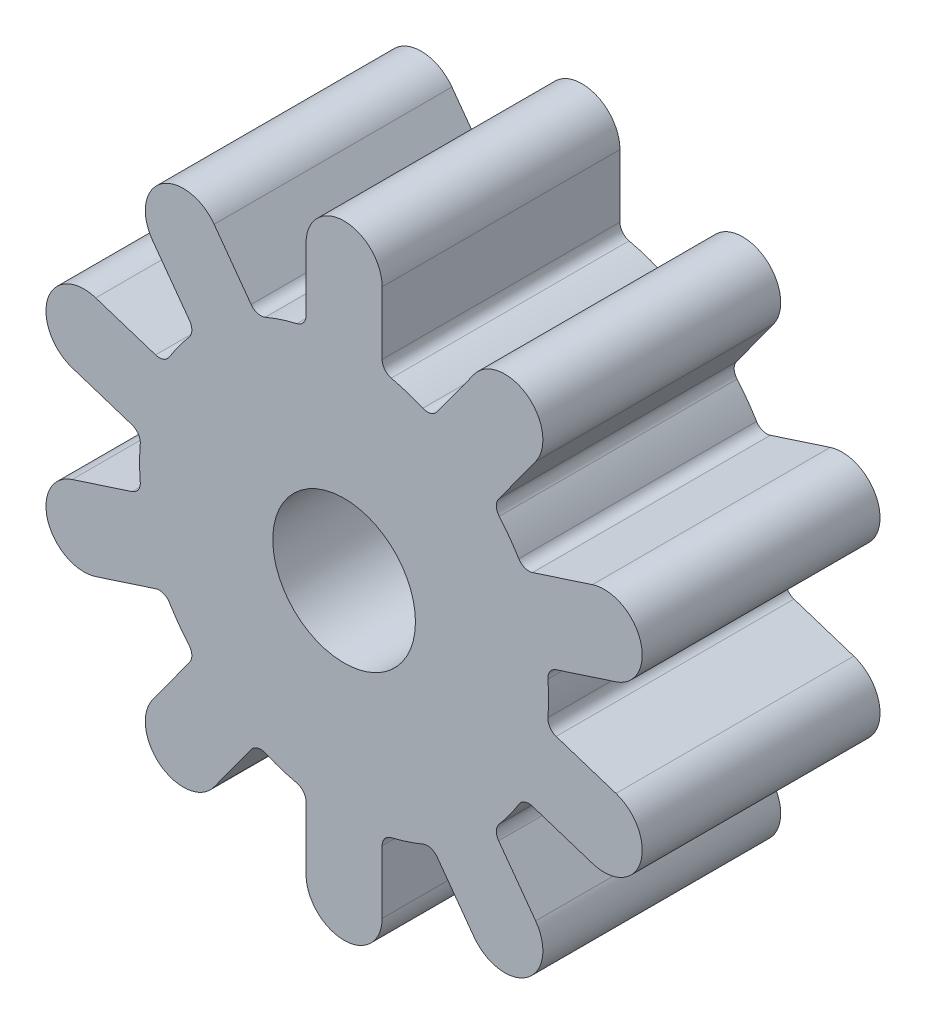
SolidWorks part; units mm, degrees
ref_plane "Front Plane" through (0, 0, 0) normal (0, 0, 1) x (1, 0, 0)
ref_plane "Top Plane" through (0, 0, 0) normal (0, 1, 0) x (1, 0, 0)
ref_plane "Right Plane" through (0, 0, 0) normal (1, 0, 0) x (0, 0, -1)
sketch "Sketch1" plane through (0, 0, 0) normal (0, 0, 1) x (1, 0, 0)
  line L0 (-1.6, 11.5) -> (-1.6, 8.8544)
  line L1 (1.6, 11.5) -> (1.6, 8.8544)
  line L2 (5.4651, 10.2442) -> (3.91, 8.1038)
  line L3 (8.054, 8.3632) -> (6.4989, 6.2229)
  line L4 (10.4427, 5.0754) -> (7.9266, 4.2578)
  line L5 (11.4316, 2.032) -> (8.9154, 1.2145)
  line L6 (11.4316, -2.032) -> (8.9154, -1.2145)
  line L7 (10.4427, -5.0754) -> (7.9266, -4.2578)
  line L8 (8.054, -8.3632) -> (6.4989, -6.2229)
  line L9 (5.4651, -10.2442) -> (3.91, -8.1038)
  line L10 (1.6, -11.5) -> (1.6, -8.8544)
  line L11 (-1.6, -11.5) -> (-1.6, -8.8544)
  line L12 (-5.4651, -10.2442) -> (-3.91, -8.1038)
  line L13 (-8.054, -8.3632) -> (-6.4989, -6.2229)
  line L14 (-10.4427, -5.0754) -> (-7.9266, -4.2578)
  line L15 (-11.4316, -2.032) -> (-8.9154, -1.2145)
  line L16 (-11.4316, 2.032) -> (-8.9154, 1.2145)
  line L17 (-10.4427, 5.0754) -> (-7.9266, 4.2578)
  line L18 (-8.054, 8.3632) -> (-6.4989, 6.2229)
  line L19 (-5.4651, 10.2442) -> (-3.91, 8.1038)
  arc A0 (1.6, 8.8544) -> (1.9846, 8.3679) centre (2.1, 8.8544) ccw
  arc A1 (-1.9846, 8.3679) -> (-3.3129, 7.9363) centre (0, 0) ccw
  arc A2 (1.6, 11.5) -> (-1.6, 11.5) centre (0, 11.5) ccw
  arc A3 (-1.6, 8.8544) -> (-1.9846, 8.3679) centre (-2.1, 8.8544) cw
  arc A4 (3.91, 8.1038) -> (3.3129, 7.9363) centre (3.5055, 8.3977) cw
  arc A5 (8.054, 8.3632) -> (5.4651, 10.2442) centre (6.7595, 9.3037) ccw
  arc A6 (6.4989, 6.2229) -> (6.5241, 5.6032) centre (6.9034, 5.929) ccw
  arc A7 (7.9266, 4.2578) -> (7.345, 4.4733) centre (7.7721, 4.7334) cw
  arc A8 (11.4316, 2.032) -> (10.4427, 5.0754) centre (10.9371, 3.5537) ccw
  arc A9 (8.9154, 1.2145) -> (8.5716, 0.6983) centre (9.0699, 0.7389) ccw
  arc A10 (8.9154, -1.2145) -> (8.5716, -0.6983) centre (9.0699, -0.7389) cw
  arc A11 (10.4427, -5.0754) -> (11.4316, -2.032) centre (10.9371, -3.5537) ccw
  arc A12 (7.9266, -4.2578) -> (7.345, -4.4733) centre (7.7721, -4.7334) ccw
  arc A13 (6.4989, -6.2229) -> (6.5241, -5.6032) centre (6.9034, -5.929) cw
  arc A14 (5.4651, -10.2442) -> (8.054, -8.3632) centre (6.7595, -9.3037) ccw
  arc A15 (3.91, -8.1038) -> (3.3129, -7.9363) centre (3.5055, -8.3977) ccw
  arc A16 (1.6, -8.8544) -> (1.9846, -8.3679) centre (2.1, -8.8544) cw
  arc A17 (-1.6, -11.5) -> (1.6, -11.5) centre (0, -11.5) ccw
  arc A18 (-1.6, -8.8544) -> (-1.9846, -8.3679) centre (-2.1, -8.8544) ccw
  arc A19 (-3.91, -8.1038) -> (-3.3129, -7.9363) centre (-3.5055, -8.3977) cw
  arc A20 (-8.054, -8.3632) -> (-5.4651, -10.2442) centre (-6.7595, -9.3037) ccw
  arc A21 (-6.4989, -6.2229) -> (-6.5241, -5.6032) centre (-6.9034, -5.929) ccw
  arc A22 (-7.9266, -4.2578) -> (-7.345, -4.4733) centre (-7.7721, -4.7334) cw
  arc A23 (-11.4316, -2.032) -> (-10.4427, -5.0754) centre (-10.9371, -3.5537) ccw
  arc A24 (-8.9154, -1.2145) -> (-8.5716, -0.6983) centre (-9.0699, -0.7389) ccw
  arc A25 (-8.9154, 1.2145) -> (-8.5716, 0.6983) centre (-9.0699, 0.7389) cw
  arc A26 (-10.4427, 5.0754) -> (-11.4316, 2.032) centre (-10.9371, 3.5537) ccw
  arc A27 (-7.9266, 4.2578) -> (-7.345, 4.4733) centre (-7.7721, 4.7334) ccw
  arc A28 (-6.4989, 6.2229) -> (-6.5241, 5.6032) centre (-6.9034, 5.929) cw
  arc A29 (-5.4651, 10.2442) -> (-8.054, 8.3632) centre (-6.7595, 9.3037) ccw
  arc A30 (-3.91, 8.1038) -> (-3.3129, 7.9363) centre (-3.5055, 8.3977) ccw
  arc A31 (-6.5241, 5.6032) -> (-7.345, 4.4733) centre (0, 0) ccw
  arc A32 (3.3129, 7.9363) -> (1.9846, 8.3679) centre (0, 0) ccw
  arc A33 (-8.5716, 0.6983) -> (-8.5716, -0.6983) centre (0, 0) ccw
  arc A34 (-7.345, -4.4733) -> (-6.5241, -5.6032) centre (0, 0) ccw
  arc A35 (7.345, 4.4733) -> (6.5241, 5.6032) centre (0, 0) ccw
  arc A36 (8.5716, -0.6983) -> (8.5716, 0.6983) centre (0, 0) ccw
  arc A37 (6.5241, -5.6032) -> (7.345, -4.4733) centre (0, 0) ccw
  arc A38 (-3.3129, -7.9363) -> (-1.9846, -8.3679) centre (0, 0) ccw
  arc A39 (1.9846, -8.3679) -> (3.3129, -7.9363) centre (0, 0) ccw
  point P94 (0, 0)
  dimension "D1" = 0.5
  dimension "D2" = 17.2
  dimension "D3" = 3.2
  dimension "D4" = 10
extrude "Boss-Extrude1" add sketch "Sketch1" along normal blind 10
sketch "Sketch2" plane through (0, 0, 10) normal (0, 0, 1) x (1, 0, 0)
  circle A0 centre (0, 0) radius 3
  dimension "D1" = 6
extrude "Cut-Extrude1" cut sketch "Sketch2" against normal blind 10
